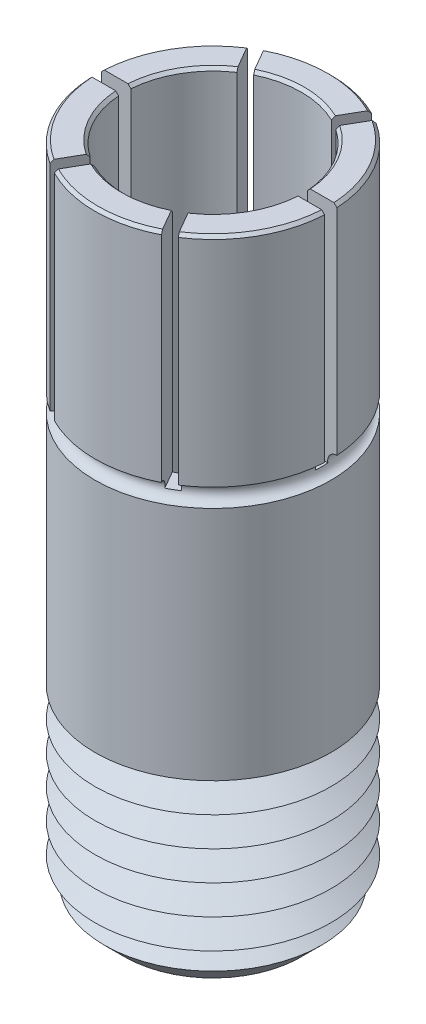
SolidWorks part; units mm, degrees
ref_plane "Front Plane" through (0, 0, 0) normal (0, 0, 1) x (1, 0, 0)
ref_plane "Top Plane" through (0, 0, 0) normal (0, 1, 0) x (1, 0, 0)
ref_plane "Right Plane" through (0, 0, 0) normal (1, 0, 0) x (0, 0, -1)
sketch "Sketch1" plane through (0, 0, 0) normal (1, 0, 0) x (0, 0, -1)
  line L0 (0, 63.0319) -> (0, -63.6896) construction
sketch "Sketch2" plane through (0, 0, 0) normal (1, 0, 0) x (0, 0, -1)
  line L0 (-6, 6.8253) -> (-6, -25.1747)
  line L1 (-6, -25.1747) -> (-8, -25.1747)
  line L2 (-8, -25.1747) -> (-8, -9.1747)
  line L3 (-8, 6.8253) -> (-6, 6.8253)
  line L4 (0, 63.0319) -> (0, -63.6896) construction
  line L6 (-8, -7.9247) -> (-8, 6.8253)
  arc A0 (-8, -9.1747) -> (-8, -7.9247) centre (-8, -8.5497) ccw
  point P10 (-8, -9.1747)
  point P11 (-8, -7.9247)
  point P12 (-8, -9.1747)
  point P13 (-8, -7.9247)
  dimension "D3" = 1.25
  dimension "D1" = 6
  dimension "D2" = 8
  dimension "D4" = 16
  dimension "D5" = 32
revolve "Revolve1" add sketch "Sketch2" angle 360 about L0
chamfer "Chamfer1" distance 0.2 angle 45 2 edges at (0, 6.8253, 8) (0, 6.8253, 6)
sketch "Sketch5" plane through (0, 6.8253, 0) normal (0, 1, 0) x (1, 0, 0)
  line L2 (-4.9826, -0.4167) -> (-7.9891, -0.4167)
  line L4 (-4.9826, 0.4167) -> (-7.9891, 0.4167)
  line L6 (-4.9887, -0.3355) -> (-7.958, 0.8184) construction
  line L7 (-4.9887, 0.3355) -> (-7.9905, -0.3892) construction
  arc A0 (-4.9826, 0.4167) -> (-4.9826, -0.4167) centre (0, 0) ccw
  arc A1 (-7.9891, 0.4167) -> (-7.9891, -0.4167) centre (0, 0) ccw
  circle A2 centre (0, 0) radius 8 construction
  point P3 (-6.0538, 0.0784)
  dimension "D1" = 3
extrude "Cut-Extrude1" cut sketch "Sketch5" against normal blind 15.5
pattern_circular "CirPattern1" count 6 over 360 about axis through (0, 0, 0) along (0, 1, 0) of "Cut-Extrude1"
sketch "Sketch8" plane through (0, -25.1747, 0) normal (0, -1, 0) x (1, 0, 0)
  circle A0 centre (0, 0) radius 8
  dimension "D1" = 16
extrude "Boss-Extrude1" add sketch "Sketch8" along normal blind 13
chamfer "Chamfer2" distance 2 angle 45 1 edges at (0, -38.1747, -8)
sketch "Sketch10" plane through (0, 0, 0) normal (1, 0, 0) x (0, 0, -1)
  line L0 (8, -25.1747) -> (6.2679, -26.1747)
  line L1 (8, -36.1747) -> (8, -9.1747) construction
  line L2 (6.2679, -26.1747) -> (8, -27.1747)
  line L3 (8, -36.1747) -> (8, -9.1747) construction
  line L4 (8, -27.1747) -> (8, -25.1747)
  line L5 (-6, -38.1747) -> (6, -38.1747) construction
  point P8 (8, -25.1747)
  point P9 (8, -25.1747)
  dimension "D1" = 2
  dimension "D2" = 13
revolve "Cut-Revolve1" cut sketch "Sketch10" angle 360 about L0
pattern_linear "LPattern1" count 7 spacing 2 along (0, -1, 0) of "Cut-Revolve1"
